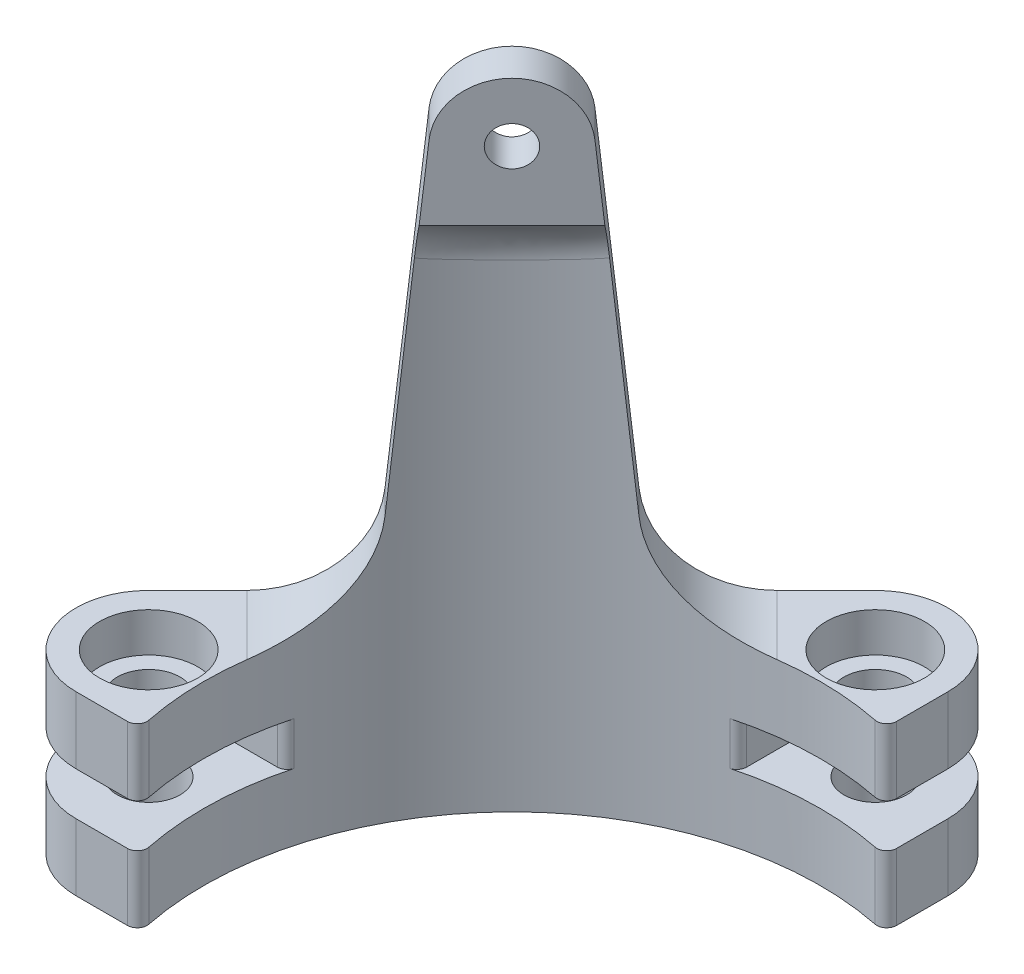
SolidWorks part; units mm, degrees
ref_plane "Front Plane" through (0, 0, 0) normal (0, 0, 1) x (1, 0, 0)
ref_plane "Top Plane" through (0, 0, 0) normal (0, 1, 0) x (1, 0, 0)
ref_plane "Right Plane" through (0, 0, 0) normal (1, 0, 0) x (0, 0, -1)
sketch "Sketch1" plane through (0, 0, 0) normal (0, 1, 0) x (1, 0, 0)
  line L0 (-18.5, 0) -> (-26.9814, 8.4814) construction
  line L1 (-3.7, 18.5) -> (3.7, 18.5)
  line L2 (-3.7, 18.5) -> (-3.7, -18.5)
  line L3 (-3.7, -18.5) -> (3.7, -18.5)
  line L4 (3.7, 18.5) -> (3.7, -18.5)
  line L5 (-3.7, 18.5) -> (3.7, -18.5) construction
  line L6 (-3.7, -18.5) -> (3.7, 18.5) construction
  line L7 (-18.5, 3.7) -> (18.5, 3.7)
  line L8 (-18.5, 3.7) -> (-18.5, -3.7)
  line L9 (-18.5, -3.7) -> (18.5, -3.7)
  line L10 (18.5, 3.7) -> (18.5, -3.7)
  line L11 (-18.5, 3.7) -> (18.5, -3.7) construction
  line L12 (-18.5, -3.7) -> (18.5, 3.7) construction
  line L13 (0, 18.5) -> (-2.6163, 21.1163) construction
  line L14 (-21.1163, 2.6163) -> (-2.6163, 21.1163)
  line L15 (-11.8663, 11.8663) -> (-13.9876, 13.9876) construction
  line L16 (-17.1696, 10.8056) -> (-10.8056, 17.1696)
  line L17 (-10.8056, 17.1696) -> (-8.6843, 15.0483)
  line L18 (-17.1696, 10.8056) -> (-15.0483, 8.6843)
  circle A0 centre (0, 0) radius 15.7
  circle A2 centre (-18.5, 0) radius 3.7
  circle A3 centre (0, 18.5) radius 3.7
  dimension "D1" = 31.4
  dimension "D2" = 7.4
  dimension "D3" = 7.4
  dimension "D4" = 37
  dimension "D5" = 37
  dimension "D6" = 3
  dimension "D7" = 4.5
extrude "Boss-Extrude1" add sketch "Sketch1" along normal blind 9 contours A3 L14 A2 L7 A0 L2 | L16 L18 L14 L17 | L8 A2 | L8 A2 A0 | A2 A0 L7 | A2 L9 A0 | A0 A3 L1 | L1 A3 | A3 A0 L4 | A3 L2 A0
fillet "Fillet1" radius 4.5 4 edges at (-9.745, 0, -16.1089) (-9.745, 9, -16.1089) (-16.1089, 0, -9.745) (-16.1089, 9, -9.745)
sketch "Sketch2" plane through (-13.9876, 0, -13.9876) normal (-0.7071, 0, -0.7071) x (-0.7071, 0, 0.7071)
  circle A0 centre (0, 4.5) radius 3.1
  dimension "D1" = 6.2
extrude "Cut-Extrude1" cut sketch "Sketch2" against normal blind 3.1
sketch "Sketch3" plane through (-11.7956, 0, -11.7956) normal (-0.7071, 0, -0.7071) x (-0.7071, 0, 0.7071)
  circle A0 centre (0, 4.5) radius 2.75
  dimension "D1" = 5.5
extrude "Cut-Extrude2" cut sketch "Sketch3" against normal blind 0.5
ref_plane "Plane1" through (0, 5.6, 0) normal (0, 1, 0) x (1, 0, 0)
sketch "Sketch4" plane through (0, 5.6, 0) normal (0, 1, 0) x (1, 0, 0)
  line L1 (-3.7, -18.5) -> (3.7, -18.5)
  line L2 (-3.7, -18.5) -> (-3.7, 18.5)
  line L3 (-3.7, 18.5) -> (3.7, 18.5)
  line L4 (3.7, -18.5) -> (3.7, 18.5)
  line L5 (-3.7, -18.5) -> (3.7, 18.5) construction
  line L6 (-3.7, 18.5) -> (3.7, -18.5) construction
  line L7 (18.5, -3.7) -> (-18.5, -3.7)
  line L8 (18.5, -3.7) -> (18.5, 3.7)
  line L9 (18.5, 3.7) -> (-18.5, 3.7)
  line L10 (-18.5, -3.7) -> (-18.5, 3.7)
  line L11 (18.5, -3.7) -> (-18.5, 3.7) construction
  line L12 (18.5, 3.7) -> (-18.5, -3.7) construction
  circle A0 centre (-18.5, 0) radius 3.7
  circle A1 centre (0, 18.5) radius 3.7
  point P6 (0, 0)
  point P13 (0, 0)
extrude "Cut-Extrude3" cut sketch "Sketch4" against normal blind 2.2 contours L3 A1 | L3 A1 | A1 L2 L9 L4 | L10 A0 | L10 A0 | A0 L7 L2 L9
sketch "Sketch5" plane through (0, 9, 0) normal (0, 1, 0) x (1, 0, 0)
  circle A0 centre (-18.5, 0) radius 2.5
  circle A1 centre (0, 18.5) radius 2.5
  dimension "D1" = 5
  dimension "D2" = 5
extrude "Cut-Extrude4" cut sketch "Sketch5" against normal blind 2
sketch "Sketch6" plane through (0, 0, 0) normal (0, -1, 0) x (-1, 0, 0)
  circle A0 centre (18.5, 0) radius 1.6
  circle A1 centre (0, 18.5) radius 1.6
  dimension "D1" = 3.2
  dimension "D2" = 3.2
extrude "Cut-Extrude5" cut sketch "Sketch6" against normal blind 9
fillet "Fillet2" radius 0.5 4 edges at (-2.6163, 4.5, -21.1163) (-21.1163, 4.5, -2.6163) (-3.7, 4.5, -15.2578) (-15.2578, 4.5, -3.7)
fillet "Fillet3" radius 0.5 4 edges at (3.7, 7.3, -15.2578) (3.7, 1.7, -15.2578) (-15.2578, 7.3, 3.7) (-15.2578, 1.7, 3.7)
fillet "Fillet4" radius 1.5 4 edges at (-9.6163, 1.318, -14.1163) (-14.1163, 1.318, -9.6163) (-14.1163, 7.682, -9.6163) (-9.6163, 7.682, -14.1163)
fillet "Fillet5" radius 1.5 4 edges at (-16.2376, 1.318, -11.7376) (-11.7376, 1.318, -16.2376) (-11.7376, 7.682, -16.2376) (-16.2376, 7.682, -11.7376)
sketch "Sketch7" plane through (-11.8663, 0, -11.8663) normal (-0.7071, 0, -0.7071) x (-0.7071, 0, 0.7071)
  line L0 (-3.9686, 9) -> (-13.0815, 9) construction
  line L1 (-5, 9) -> (5, 9)
  line L2 (-5, 9) -> (-5, 38.6294)
  line L3 (-5, 38.6294) -> (5, 38.6294)
  line L4 (5, 9) -> (5, 38.6294)
  line L5 (-5, 9) -> (-2.9867, 30.2825)
  line L6 (5, 9) -> (2.9867, 30.2825)
  circle A0 centre (0, 30) radius 1
  circle A1 centre (0, 4.5) radius 3.1 construction
  circle A3 centre (0, 30) radius 3
  dimension "D3" = 2
  dimension "D5" = 6
  dimension "D1" = 10
  dimension "D2" = 5
  dimension "D4" = 25.5
extrude "Boss-Extrude2" add sketch "Sketch7" against normal blind 2 contours A3 A0 | A3 L5 L1 L6 M14
sketch "Sketch8" plane through (0, 9, 0) normal (0, -1, 0) x (-1, 0, 0)
  circle A0 centre (0, 0) radius 15.7
extrude "Cut-Extrude6" cut sketch "Sketch8" against normal blind 17.5
fillet "Fillet6" radius 3 1 edges at (-11.1016, 26.5, -11.1016)
sketch "Sketch9" plane through (-11.8663, 0, -11.8663) normal (-0.7071, 0, -0.7071) x (-0.7071, 0, 0.7071)
  line L0 (13.0815, 9) -> (5, 9) construction
  line L1 (1, 10) -> (-1, 10)
  line L2 (1, 10) -> (1, 28)
  line L3 (1, 28) -> (-1, 28)
  line L4 (-1, 10) -> (-1, 28)
  line L5 (1, 10) -> (-1, 28) construction
  line L6 (1, 28) -> (-1, 10) construction
  point P0 (0, 19)
  dimension "D1" = 10
  dimension "D2" = 18
  dimension "D3" = 2
extrude "Boss-Extrude3" add sketch "Sketch9" along normal blind 1.5
fillet "Fillet7" radius 1.5 2 edges at (-11.1592, 19, -12.5734) (-12.5734, 19, -11.1592)
fillet "Fillet8" radius 1.5 2 edges at (-12.2198, 19, -13.6341) (-13.6341, 19, -12.2198)
fillet "Fillet9" radius 0.75 8 edges at (-10.771, 28, -13.2458) (-13.2458, 28, -10.771) (-10.771, 10, -13.2458) (-13.2458, 10, -10.771) (-12.2763, 28, -13.2578) (-13.2578, 28, -12.2763) (-12.2763, 10, -13.2578) (-13.2578, 10, -12.2763)
fillet "Fillet10" radius 5 2 edges at (-14.7305, 9, -7.6594) (-7.6594, 9, -14.7305)
